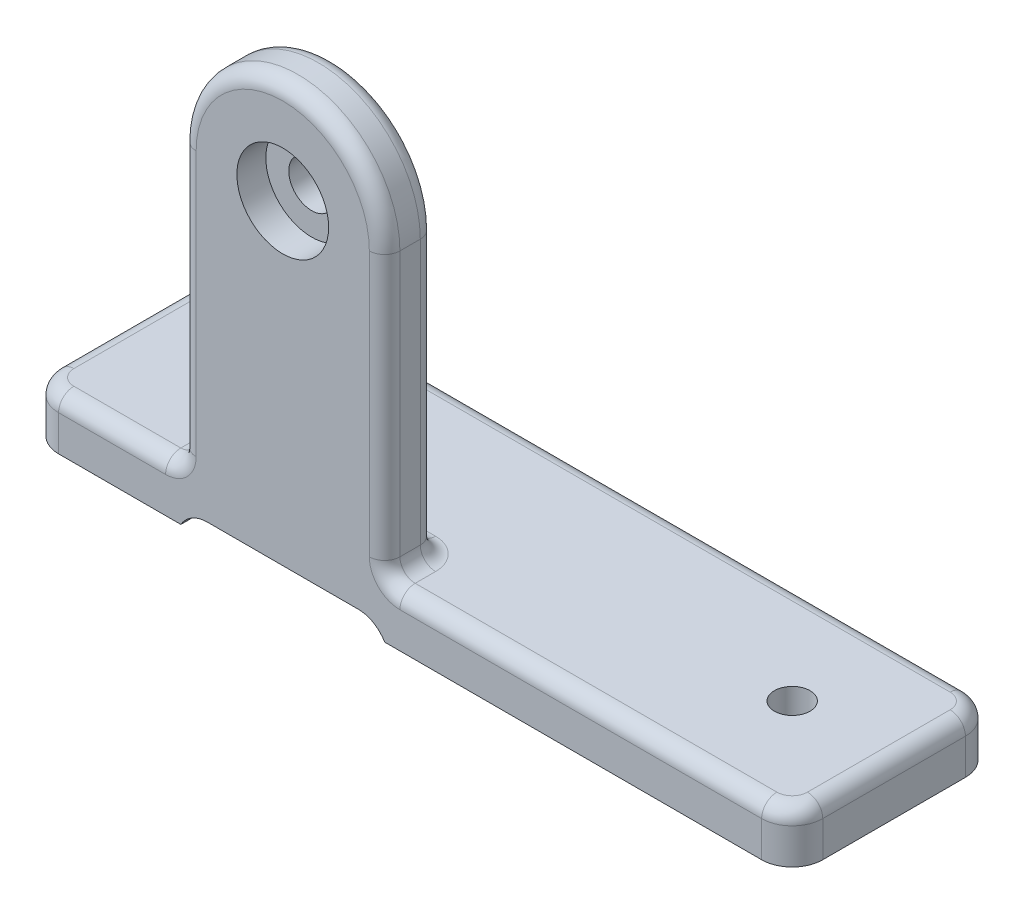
SolidWorks part; units mm, degrees
ref_plane "Front Plane" through (0, 0, 0) normal (0, 0, 1) x (1, 0, 0)
ref_plane "Top Plane" through (0, 0, 0) normal (0, 1, 0) x (1, 0, 0)
ref_plane "Right Plane" through (0, 0, 0) normal (1, 0, 0) x (0, 0, -1)
sketch "Sketch1" plane through (0, 0, 0) normal (0, 1, 0) x (1, 0, 0)
  line L1 (0, 0) -> (150, 0)
  line L2 (0, 0) -> (0, 40)
  line L3 (0, 40) -> (150, 40)
  line L4 (150, 0) -> (150, 40)
  dimension "D1" = 150
  dimension "D2" = 40
extrude "Base Plate" add sketch "Sketch1" along normal blind 10
sketch "Sketch2" plane through (0, 0, 0) normal (0, 0, 1) x (1, 0, 0)
  line L0 (30, 0) -> (30, 65)
  line L1 (0, 0) -> (150, 0) construction
  line L2 (70, 65) -> (70, 0)
  line L3 (70, 0) -> (30, 0)
  line L4 (0, 10) -> (0, 0) construction
  arc A0 (30, 65) -> (70, 65) centre (50, 65) cw
  dimension "D1" = 20
  dimension "D2" = 50
  dimension "D3" = 65
extrude "Vert Boss" add sketch "Sketch2" against normal blind 10
sketch "Sketch5" plane through (0, 0, 0) normal (0, 0, 1) x (1, 0, 0)
  line L0 (0, 0) -> (150, 0) construction
  line L1 (30, 0) -> (70, 0)
  line L2 (30, 0) -> (30, 3)
  line L3 (30, 3) -> (70, 3)
  line L4 (70, 0) -> (70, 3)
  line L5 (30, 65) -> (30, 10) construction
  line L6 (70, 10) -> (70, 65) construction
  dimension "D1" = 3
extrude "Slot" cut sketch "Sketch5" against normal through all
hole_wizard "Ø7.0 (7) Diameter Hole1" positions "Sketch9" profile "Sketch8" hole size "Ø7.0" standard "Ansi Metric"
sketch "Sketch9" plane through (0, 10, 0) normal (0, 1, 0) x (-1, 0, 0)
  line L0 (-150, 0) -> (-150, -40) construction
  line L1 (-150, -40) -> (0, -40) construction
  line L2 (0, -40) -> (0, 0) construction
  point P0 (-130, -20)
  point P1 (-20, -20)
  dimension "D1" = 20
  dimension "D2" = 20
  dimension "D3" = 20
sketch "Sketch8" plane through (130, 10, -20) normal (1, 0, 0) x (0, 0, 1)
  line L0 (0, 0) -> (0, 10)
  line L1 (0, 10) -> (3.5, 10)
  line L2 (3.5, 10) -> (3.5, 0)
  line L5 (3.5, 0) -> (0, 0)
  line L11 (0, -6.35) -> (0, 107.95) construction
  dimension "Thru Hole Dia." = 7
  dimension "Thru Hole Depth" = 10
hole_wizard "CBORE for M8 Hex Head Bolt1" positions "Sketch4" profile "Sketch3" counterbore size "M8" standard "Ansi Metric"
sketch "Sketch4" plane through (0, 0, 0) normal (0, 0, 1) x (1, 0, 0)
  point P0 (50, 65)
sketch "Sketch3" plane through (50, 65, 0) normal (1, 0, 0) x (0, -1, 0)
  line L0 (0, 0) -> (0, 40)
  line L1 (0, 40) -> (4.5, 40)
  line L3 (4.5, 40) -> (4.5, 5.68)
  line L4 (4.5, 5.68) -> (9.005, 5.68)
  line L5 (9.005, 5.68) -> (9.005, 0)
  line L7 (9.005, 0) -> (0, 0)
  line L11 (0, -6.35) -> (0, 107.95) construction
  dimension "Thru Hole Dia." = 9
  dimension "Thru Hole Depth" = 40
  dimension "C'Bore Dia." = 18.01
  dimension "C'Bore Depth" = 5.68
fillet "Fillet1" radius 6 6 edges at (70, 3, -20) (30, 3, -20) (0, 5, 0) (0, 5, -40) (150, 5, -40) (150, 5, 0)
fillet "Fillet2" radius 3 18 edges at (1.7574, 10, -38.2426) (0, 10, -20) (75, 10, -40) (1.7574, 10, -1.7574) (148.2426, 10, -38.2426) (18, 10, 0) (150, 10, -20) (30, 10, -5) (148.2426, 10, -1.7574) (50, 10, -10) (107, 10, 0) (70, 37.5, -10) (30, 37.5, -10) (70, 37.5, 0) (30, 37.5, 0) (70, 10, -5) (50, 85, -10) (50, 85, 0)
